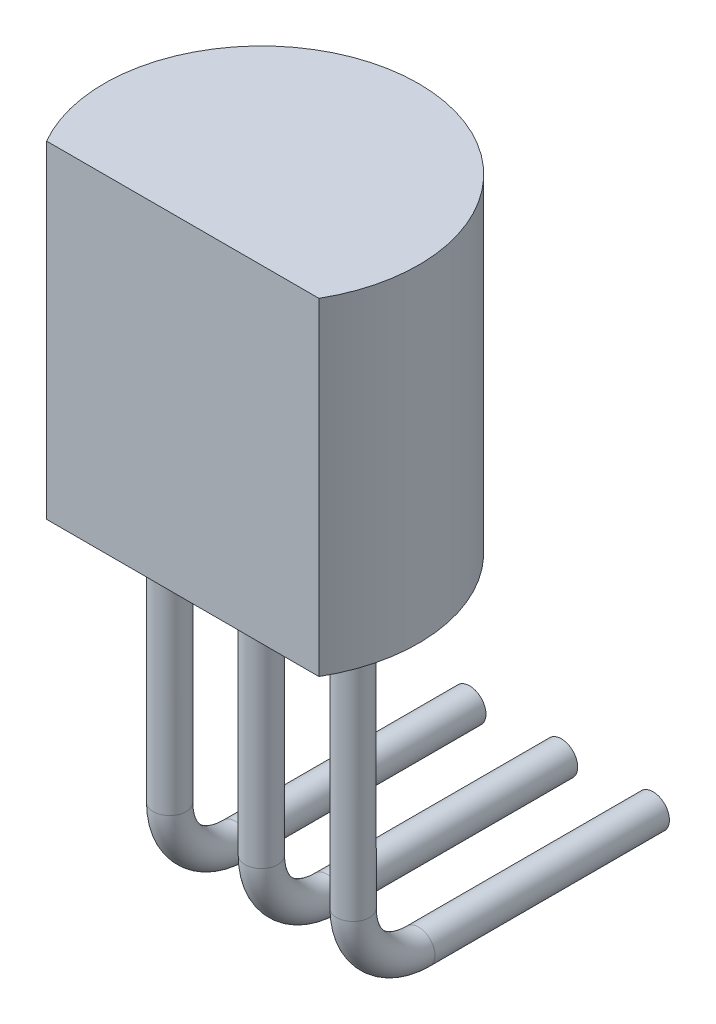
SolidWorks part; units mm, degrees
ref_plane "Plan de face" through (0, 0, 0) normal (0, 0, 1) x (1, 0, 0)
ref_plane "Plan de dessus" through (0, 0, 0) normal (0, 1, 0) x (1, 0, 0)
ref_plane "Plan de droite" through (0, 0, 0) normal (1, 0, 0) x (0, 0, -1)
sketch "Esquisse2" plane through (0, 0, 0) normal (0, 1, 0) x (1, 0, 0)
  line L0 (-2.0785, -1.2) -> (2.0785, -1.2)
  arc A0 (2.0785, -1.2) -> (-2.0785, -1.2) centre (0, 0) ccw
  dimension "D1" = 4.8
  dimension "D2" = 1.2
extrude "Extrusion1" add sketch "Esquisse2" along normal blind 5
sketch "Esquisse6" plane through (0, 0, 0) normal (0, -1, 0) x (1, 0, 0)
  line L0 (0, 3.1204) -> (0, -4.1965) construction
  line L1 (1.4, -4.1965) -> (1.4, 3.1204) construction
  line L2 (-1.4, -4.1965) -> (-1.4, 3.1204) construction
  line L3 (3.6641, 0) -> (-4.9473, 0) construction
  circle A0 centre (0, 0) radius 0.25
  circle A2 centre (1.4, 0) radius 0.25
  circle A3 centre (-1.4, 0) radius 0.25
  dimension "D1" = 1.4
  dimension "D2" = 1.4
sketch "Esquisse8" plane through (0, 0, 0) normal (1, 0, 0) x (0, 0, -1)
  line L0 (0, -5.2319) -> (0, 7.5757) construction
  line L1 (-3.261, -5) -> (6.2315, -5) construction
  line L2 (2.9781, 7.5757) -> (2.9781, -5.9732) construction
  line L3 (4.5781, 7.5757) -> (4.5781, -5.9732) construction
  line L4 (0, 0) -> (0, -4)
  line L5 (1, -5) -> (4.5781, -5)
  arc A0 (0, -4) -> (1, -5) centre (1, -4) ccw
  dimension "D2" = 1
  dimension "D1" = 1.6
sweep "Balayage1" add profiles "Esquisse6" path "Esquisse8"
